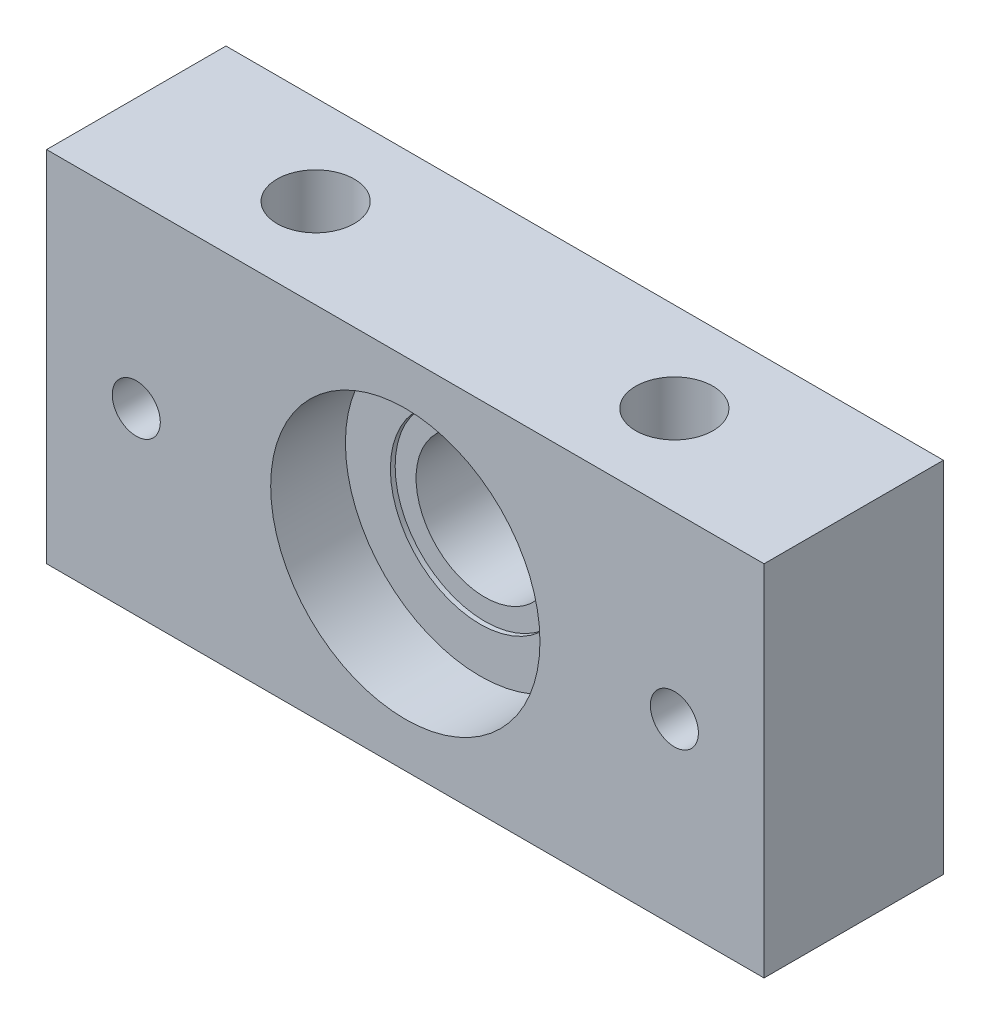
SolidWorks part; units mm, degrees
ref_plane "Front" through (0, 0, 0) normal (0, 0, 1) x (1, 0, 0)
ref_plane "Top" through (0, 0, 0) normal (0, 1, 0) x (1, 0, 0)
ref_plane "Side" through (0, 0, 0) normal (1, 0, 0) x (0, 0, -1)
sketch "Sketch1" plane through (0, 0, 0) normal (0, 0, 1) x (1, 0, 0)
  line L1 (0, 0) -> (76.2, 0)
  line L2 (0, 0) -> (0, 38.1)
  line L3 (0, 38.1) -> (76.2, 38.1)
  line L4 (76.2, 0) -> (76.2, 38.1)
  dimension "D1" = 76.2
  dimension "D2" = 38.1
extrude "Extrude1" add sketch "Sketch1" along normal blind 19.05
hole_wizard "5/16 Clearance Hole1" positions "Sketch4" profile "Sketch3" hole size "5/16" standard "Ansi Inch"
sketch "Sketch4" plane through (0, 38.1, 0) normal (0, 1, 0) x (-1, 0, 0)
  line L0 (-76.2, 9.525) -> (0, 9.525) construction
  line L1 (-76.2, 19.05) -> (-76.2, 0) construction
  line L2 (0, 19.05) -> (0, 0) construction
  line L3 (-38.1, 9.525) -> (-38.1, 19.05) construction
  line L4 (-76.2, 19.05) -> (0, 19.05) construction
  point P0 (-19.05, 9.525)
  point P14 (-57.15, 9.525)
  dimension "D1" = 38.1
sketch "Sketch3" plane through (19.05, 38.1, 9.525) normal (1, 0, 0) x (0, 0, 1)
  line L0 (0, 0) -> (0, 38.1)
  line L1 (0, 38.1) -> (4.1021, 38.1)
  line L2 (4.1021, 38.1) -> (4.1021, 0)
  line L5 (4.1021, 0) -> (0, 0)
  line L11 (0, -6.35) -> (0, 107.95) construction
  dimension "Thru Hole Dia." = 8.2042
  dimension "Thru Hole Depth" = 38.1
sketch "Sketch5" plane through (0, 0, 19.05) normal (0, 0, 1) x (1, 0, 0)
  line L0 (76.2, 19.05) -> (0, 19.05) construction
  line L1 (76.2, 0) -> (76.2, 38.1) construction
  line L2 (0, 38.1) -> (0, 0) construction
  circle A0 centre (38.1, 19.05) radius 14.3002
  dimension "D1" = 28.6004
extrude "Cut-Extrude1" cut sketch "Sketch5" against normal blind 7.9375
sketch "Sketch6" plane through (0, 0, 11.1125) normal (0, 0, 1) x (1, 0, 0)
  circle A0 centre (38.1, 19.05) radius 7.3025
  dimension "D1" = 14.605
extrude "Cut-Extrude2" cut sketch "Sketch6" against normal through all
hole_wizard "1/4-20 Tapped Hole1" positions "Sketch8" profile "Sketch7" tap size "1/4-20" standard "Ansi Inch"
sketch "Sketch8" plane through (0, 0, 19.05) normal (0, 0, 1) x (1, 0, 0)
  line L0 (0, 19.05) -> (76.2, 19.05) construction
  line L1 (0, 38.1) -> (0, 0) construction
  line L2 (76.2, 0) -> (76.2, 38.1) construction
  line L3 (38.1, 19.05) -> (38.1, -6.438) construction
  point P0 (9.525, 19.05)
  point P14 (66.675, 19.05)
  dimension "D1" = 57.15
sketch "Sketch7" plane through (9.525, 19.05, 19.05) normal (1, 0, 0) x (0, -1, 0)
  line L0 (0, 0) -> (0, 19.05)
  line L1 (0, 19.05) -> (2.5527, 19.05)
  line L2 (2.5527, 19.05) -> (2.5527, 0)
  line L5 (2.5527, 0) -> (0, 0)
  line L11 (0, -6.35) -> (0, 107.95) construction
  dimension "Thru Tap Drill Dia." = 5.1054
  dimension "Thru Tap Drill Depth" = 19.05
sketch "Sketch9" plane through (0, 0, 11.1125) normal (0, 0, 1) x (1, 0, 0)
  circle A0 centre (38.1, 19.05) radius 9.525
  dimension "D1" = 19.05
extrude "Cut-Extrude3" cut sketch "Sketch9" against normal blind 0.508
